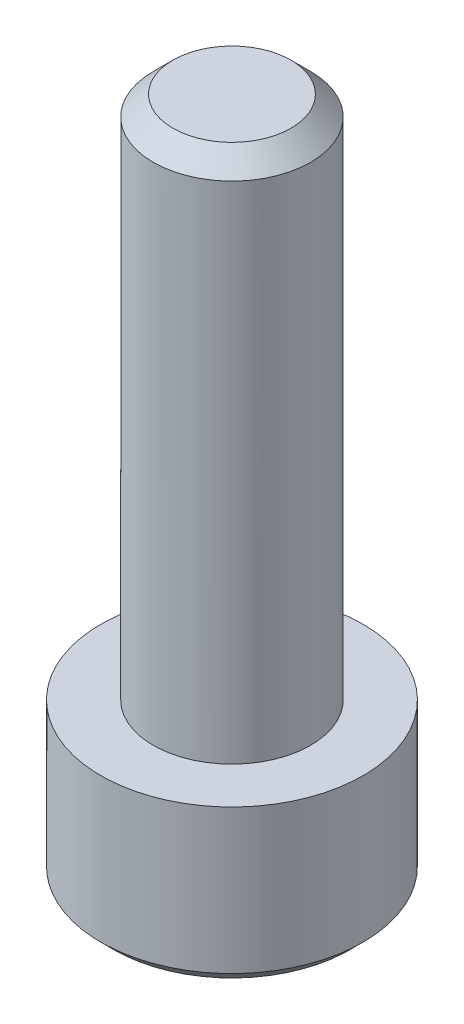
SolidWorks part; units mm, degrees
ref_plane "XY" through (0, 0, 0) normal (0, 0, 1) x (1, 0, 0)
ref_plane "XZ" through (0, 0, 0) normal (0, 1, 0) x (1, 0, 0)
ref_plane "YZ" through (0, 0, 0) normal (1, 0, 0) x (0, 0, -1)
sketch "Esquisse1" plane through (0, 0, 0) normal (0, 0, 1) x (1, 0, 0)
  line L0 (0, -0.7314) -> (0, 28.0636) construction
  line L1 (0, 0) -> (-5, 0)
  line L2 (-5, 0) -> (-5, 6)
  line L3 (0, 26) -> (0, 0)
  line L4 (-5, 6) -> (-3, 6)
  line L6 (-3, 6) -> (-3, 26)
  line L8 (-3, 26) -> (0, 26)
  point P7 (0, 0)
  dimension "D1" = 3
  dimension "D2" = 5
  dimension "D3" = 6
  dimension "D4" = 20
revolve "Base-Révolution" add sketch "Esquisse1"
chamfer "Chanfrein filetage" distance 0.75 angle 45
sketch "Esquisse2" plane through (0, 0, 0) normal (0, -1, 0) x (1, 0, 0)
  line L1 (2.8868, 0) -> (1.4434, 2.5)
  line L2 (1.4434, 2.5) -> (-1.4434, 2.5)
  line L3 (-1.4434, 2.5) -> (-2.8868, 0)
  line L4 (-2.8868, 0) -> (-1.4434, -2.5)
  line L5 (-1.4434, -2.5) -> (1.4434, -2.5)
  line L6 (1.4434, -2.5) -> (2.8868, 0)
  circle A1 centre (0, 0) radius 2.5 construction
  dimension "D1" = 5
extrude "6 pans" cut sketch "Esquisse2" against normal blind 5
chamfer "Chanfrein tête" distance 0.5 angle 45
